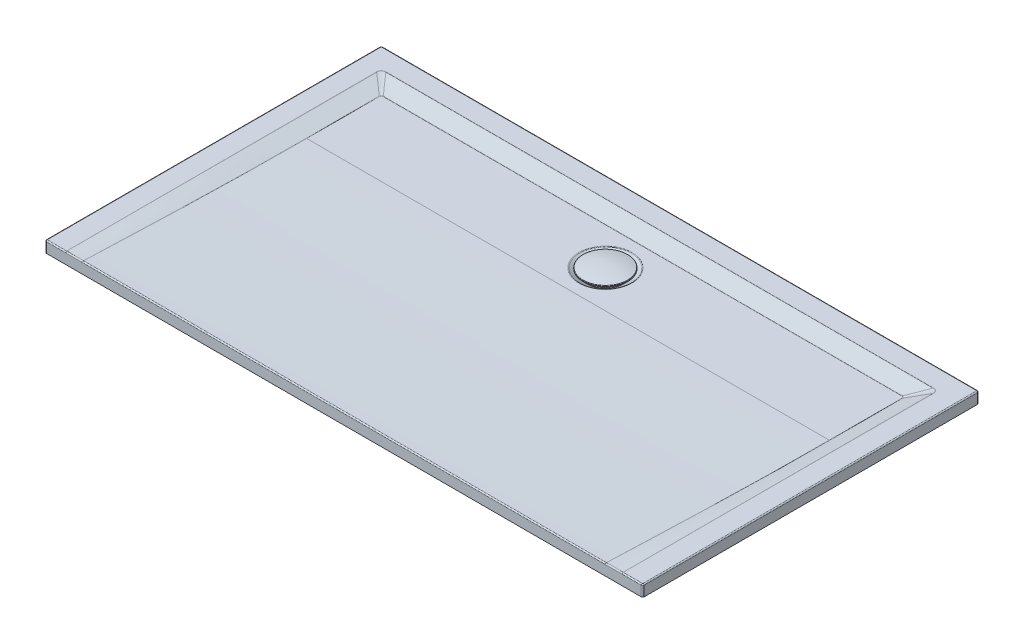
SolidWorks part; units mm, degrees
ref_plane "Płaszczyzna przednia" through (0, 0, 0) normal (0, 0, 1) x (1, 0, 0)
ref_plane "Płaszczyzna górna" through (0, 0, 0) normal (0, 1, 0) x (1, 0, 0)
ref_plane "Płaszczyzna prawa" through (0, 0, 0) normal (1, 0, 0) x (0, 0, -1)
sketch "Szkic1" plane through (0, 0, 0) normal (0, 1, 0) x (1, 0, 0)
  line L0 (0, 450) -> (0, -450) construction
  line L1 (-800, 450) -> (800, 450)
  line L2 (-800, 450) -> (-800, -450)
  line L3 (-800, -450) -> (800, -450)
  line L4 (800, 450) -> (800, -450)
  line L5 (-745, -450) -> (-745, 395)
  line L6 (-745, 395) -> (745, 395)
  line L7 (745, 395) -> (745, -450)
  line L8 (-700, -450) -> (-700, 350)
  line L9 (-700, 350) -> (700, 350)
  line L10 (700, 350) -> (700, -450)
  circle A0 centre (0, 250) radius 45
  circle A1 centre (0, 250) radius 70
  point P9 (0, 395)
  dimension "D6" = 90
  dimension "D7" = 140
  dimension "D1" = 1600
  dimension "D2" = 55
  dimension "D3" = 55
  dimension "D5" = 200
  dimension "D8" = 900
  dimension "D4" = 45
sketch "Szkic2" plane through (0, 0, 0) normal (0, 1, 0) x (1, 0, 0)
  line L0 (-800, -450) -> (800, -450) construction
  line L1 (800, 450) -> (800, -450) construction
  line L2 (745, 395) -> (745, -450) construction
  line L3 (-745, 395) -> (745, 395) construction
  line L4 (-800, 450) -> (800, 450) construction
  line L5 (-745, -450) -> (-745, 395) construction
  line L6 (-800, 450) -> (-800, -450) construction
  line L7 (-800, -450) -> (-745, -450)
  line L8 (800, 450) -> (800, -450)
  line L9 (745, 395) -> (745, -450)
  line L10 (-745, 395) -> (745, 395)
  line L11 (-800, 450) -> (800, 450)
  line L12 (-745, -450) -> (-745, 395)
  line L13 (-800, 450) -> (-800, -450)
  line L14 (745, -450) -> (800, -450)
surface "Powierzchnia-Płaszczyzna1" sketch "Szkic2"
ref_plane "Płaszczyzna1" through (0, -15, 0) normal (0, 1, 0) x (-1, 0, 0)
sketch "Szkic3" plane through (0, -15, 0) normal (0, 1, 0) x (-1, 0, 0)
  line L0 (700, -150) -> (-700, -150)
  line L1 (700, 450) -> (700, -350) construction
  line L2 (-700, -350) -> (-700, 450) construction
  line L3 (0, -150) -> (0, -350) construction
  line L4 (700, -350) -> (-700, -350) construction
  line L5 (-700, -350) -> (-700, -150)
  line L6 (700, -150) -> (700, -350)
  line L7 (700, -350) -> (-700, -350)
  circle A0 centre (0, -250) radius 70 construction
  circle A1 centre (0, -250) radius 70
  point P10 (0, -250)
surface "Powierzchnia-Płaszczyzna2" sketch "Szkic3"
sketch "Szkic4" plane through (0, 0, 0) normal (0, 1, 0) x (1, 0, 0)
  line L0 (700, -450) -> (-700, -450)
other "Granica-Powierzchnia1"
other "Granica-Powierzchnia2"
other "Granica-Powierzchnia3"
mirror "Lustro1" about plane through (0, 0, 0) normal (1, 0, 0)
sketch "Szkic5" plane through (0, 0, 0) normal (0, 1, 0) x (1, 0, 0)
  line L0 (800, 450) -> (800, -450) construction
  line L1 (-800, 450) -> (800, 450) construction
  line L2 (-800, 450) -> (-800, -450) construction
  line L3 (-800, -450) -> (800, -450) construction
  line L4 (800, 450) -> (800, -450)
  line L5 (-800, 450) -> (800, 450)
  line L6 (-800, 450) -> (-800, -450)
  line L7 (-800, -450) -> (800, -450)
surface "Powierzchnia-Wyciągnięcie1" sketch "Szkic5" parameters "D1"=30
sketch "Szkic7" plane through (0, 0, 0) normal (1, 0, 0) x (0, 0, -1)
  line L0 (250, 0) -> (250, -30) construction
  line L1 (450, -30) -> (-450, -30) construction
  line L2 (295, -30) -> (295, -28)
  line L3 (295, -28) -> (299, -28)
  line L6 (299, -28) -> (320, -15)
  dimension "D1" = 90
  dimension "D2" = 2
  dimension "D3" = 98
surface "Powierzchnia-Obrót wokół linii środkowej1" sketch "Szkic7" parameters "D1"=360
surface "Powierzchnia-Płaszczyzna3"
surface "Powierzchnia-Połącz1"
fillet "Zaokrąglenie1" radius 4 6 edges at (0, -28, -299) (0, -15, -180) (800, -15, 450) (800, -15, -450) (-800, -15, -450) (-800, -15, 450)
fillet "Zmienne zaokrąglenie1" radius 40 2 edges at (722.5, -7.5, -372.5)
fillet "Zaokrąglenie3" radius 3 12 edges
fillet "Zaokrąglenie4" radius 3 12 edges at (-798.8284, 0, -448.8284) (0, 0, -450) (798.8284, 0, -448.8284) (800, 0, 0) (798.8284, 0, 448.8284) (770.5, 0, 450) (-770.5, 0, 450) (-798.8284, 0, 448.8284) (-800, 0, 0)
sketch "Szkic8" plane through (0, 0, 0) normal (1, 0, 0) x (0, 0, -1)
  line L0 (250, 0) -> (250, -30) construction
  line L1 (250, -5.6601) -> (179.8469, -5.6601) construction
  line L2 (310, -14.7573) -> (310, -17)
  line L3 (310, -17) -> (250, -17)
  line L4 (250, -17) -> (250, -5.6601)
  line L5 (250, -5.6601) -> (199.9922, 95.6514)
  arc A0 (250, -5.6601) -> (309.2694, -13.7943) centre (250, -225.6601) cw
  arc A1 (309.2694, -13.7943) -> (310, -14.7573) centre (309, -14.7573) cw
  point P11 (310, -14)
  dimension "D1" = 220
  dimension "D4" = 1
  dimension "D2" = 60
  dimension "D3" = 3
  dimension "D5" = 13
revolve "Obrót wokół linii środkowej1" add sketch "Szkic8" angle 360 about L4
